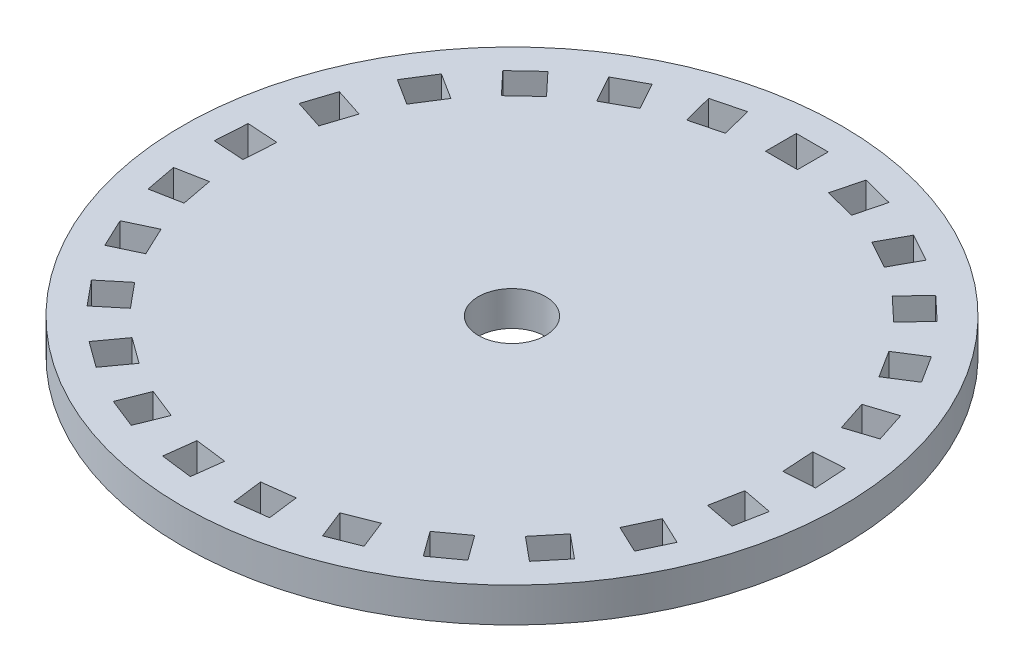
SolidWorks part; units mm, degrees
ref_plane "Front Plane" through (0, 0, 0) normal (0, 0, 1) x (1, 0, 0)
ref_plane "Top Plane" through (0, 0, 0) normal (0, 1, 0) x (1, 0, 0)
ref_plane "Right Plane" through (0, 0, 0) normal (1, 0, 0) x (0, 0, -1)
sketch "Sketch1" plane through (0, 0, 0) normal (0, 1, 0) x (1, 0, 0)
  line L0 (0, 0) -> (0, 28.575) construction
  line L1 (4.4706, 22.9781) -> (5.1338, 25.5613)
  line L2 (-1.3843, 23.368) -> (1.3843, 23.368)
  line L3 (-1.3843, 23.368) -> (-1.3843, 26.035)
  line L4 (-1.3843, 26.035) -> (1.3843, 26.035)
  line L5 (1.3843, 23.368) -> (1.3843, 26.035)
  line L6 (-1.3843, 23.368) -> (1.3843, 26.035) construction
  line L7 (-1.3843, 26.035) -> (1.3843, 23.368) construction
  line L8 (5.1338, 25.5613) -> (7.8155, 24.8728)
  line L9 (7.1522, 22.2896) -> (7.8155, 24.8728)
  line L10 (4.4706, 22.9781) -> (7.1522, 22.2896)
  line L11 (10.0445, 21.1444) -> (11.3294, 23.4815)
  line L12 (11.3294, 23.4815) -> (13.7555, 22.1478)
  line L13 (12.4707, 19.8106) -> (13.7555, 22.1478)
  line L14 (10.0445, 21.1444) -> (12.4707, 19.8106)
  line L15 (14.9874, 17.9822) -> (16.8131, 19.9263)
  line L16 (16.8131, 19.9263) -> (18.8313, 18.0311)
  line L17 (17.0056, 16.0869) -> (18.8313, 18.0311)
  line L18 (14.9874, 17.9822) -> (17.0056, 16.0869)
  line L19 (18.9885, 13.69) -> (21.2403, 15.1191)
  line L20 (21.2403, 15.1191) -> (22.7238, 12.7814)
  line L21 (20.472, 11.3524) -> (22.7238, 12.7814)
  line L22 (18.9885, 13.69) -> (20.472, 11.3524)
  line L23 (21.7965, 8.5377) -> (24.333, 9.3618)
  line L24 (24.333, 9.3618) -> (25.1885, 6.7287)
  line L25 (22.6521, 5.9046) -> (25.1885, 6.7287)
  line L26 (21.7965, 8.5377) -> (22.6521, 5.9046)
  line L27 (23.235, 2.8489) -> (25.8967, 3.0163)
  line L28 (25.8967, 3.0163) -> (26.0705, 0.2532)
  line L29 (23.4088, 0.0857) -> (26.0705, 0.2532)
  line L30 (23.235, 2.8489) -> (23.4088, 0.0857)
  line L31 (23.2135, -3.0189) -> (25.8332, -3.5187)
  line L32 (25.8332, -3.5187) -> (25.3145, -6.2383)
  line L33 (22.6947, -5.7385) -> (25.3145, -6.2383)
  line L34 (23.2135, -3.0189) -> (22.6947, -5.7385)
  line L35 (21.7334, -8.6971) -> (24.1466, -9.8326)
  line L36 (24.1466, -9.8326) -> (22.9678, -12.3377)
  line L37 (20.5546, -11.2022) -> (22.9678, -12.3377)
  line L38 (21.7334, -8.6971) -> (20.5546, -11.2022)
  line L39 (18.8877, -13.8287) -> (20.9427, -15.5287)
  line L40 (20.9427, -15.5287) -> (19.1779, -17.662)
  line L41 (17.123, -15.9619) -> (19.1779, -17.662)
  line L42 (18.8877, -13.8287) -> (17.123, -15.9619)
  line L43 (14.8553, -18.0914) -> (16.4229, -20.2491)
  line L44 (16.4229, -20.2491) -> (14.1831, -21.8764)
  line L45 (12.6154, -19.7188) -> (14.1831, -21.8764)
  line L46 (14.8553, -18.0914) -> (12.6154, -19.7188)
  line L47 (9.8894, -21.2174) -> (10.8712, -23.6971)
  line L48 (10.8712, -23.6971) -> (8.297, -24.7163)
  line L49 (7.3152, -22.2366) -> (8.297, -24.7163)
  line L50 (9.8894, -21.2174) -> (7.3152, -22.2366)
  line L51 (4.3022, -23.0102) -> (4.6364, -25.6562)
  line L52 (4.6364, -25.6562) -> (1.8897, -26.0032)
  line L53 (1.5554, -23.3572) -> (1.8897, -26.0032)
  line L54 (4.3022, -23.0102) -> (1.5554, -23.3572)
  line L55 (-1.5554, -23.3572) -> (-1.8897, -26.0032)
  line L56 (-1.8897, -26.0032) -> (-4.6364, -25.6562)
  line L57 (-4.3022, -23.0102) -> (-4.6364, -25.6562)
  line L58 (-1.5554, -23.3572) -> (-4.3022, -23.0102)
  line L59 (-7.3152, -22.2366) -> (-8.297, -24.7163)
  line L60 (-8.297, -24.7163) -> (-10.8712, -23.6971)
  line L61 (-9.8894, -21.2174) -> (-10.8712, -23.6971)
  line L62 (-7.3152, -22.2366) -> (-9.8894, -21.2174)
  line L63 (-12.6154, -19.7188) -> (-14.1831, -21.8764)
  line L64 (-14.1831, -21.8764) -> (-16.4229, -20.2491)
  line L65 (-14.8553, -18.0914) -> (-16.4229, -20.2491)
  line L66 (-12.6154, -19.7188) -> (-14.8553, -18.0914)
  line L67 (-17.123, -15.9619) -> (-19.1779, -17.662)
  line L68 (-19.1779, -17.662) -> (-20.9427, -15.5287)
  line L69 (-18.8877, -13.8287) -> (-20.9427, -15.5287)
  line L70 (-17.123, -15.9619) -> (-18.8877, -13.8287)
  line L71 (-20.5546, -11.2022) -> (-22.9678, -12.3377)
  line L72 (-22.9678, -12.3377) -> (-24.1466, -9.8326)
  line L73 (-21.7334, -8.6971) -> (-24.1466, -9.8326)
  line L74 (-20.5546, -11.2022) -> (-21.7334, -8.6971)
  line L75 (-22.6947, -5.7385) -> (-25.3145, -6.2383)
  line L76 (-25.3145, -6.2383) -> (-25.8332, -3.5187)
  line L77 (-23.2135, -3.0189) -> (-25.8332, -3.5187)
  line L78 (-22.6947, -5.7385) -> (-23.2135, -3.0189)
  line L79 (-23.4088, 0.0857) -> (-26.0705, 0.2532)
  line L80 (-26.0705, 0.2532) -> (-25.8967, 3.0163)
  line L81 (-23.235, 2.8489) -> (-25.8967, 3.0163)
  line L82 (-23.4088, 0.0857) -> (-23.235, 2.8489)
  line L83 (-22.6521, 5.9046) -> (-25.1885, 6.7287)
  line L84 (-25.1885, 6.7287) -> (-24.333, 9.3618)
  line L85 (-21.7965, 8.5377) -> (-24.333, 9.3618)
  line L86 (-22.6521, 5.9046) -> (-21.7965, 8.5377)
  line L87 (-20.472, 11.3524) -> (-22.7238, 12.7814)
  line L88 (-22.7238, 12.7814) -> (-21.2403, 15.1191)
  line L89 (-18.9885, 13.69) -> (-21.2403, 15.1191)
  line L90 (-20.472, 11.3524) -> (-18.9885, 13.69)
  line L91 (-17.0056, 16.0869) -> (-18.8313, 18.0311)
  line L92 (-18.8313, 18.0311) -> (-16.8131, 19.9263)
  line L93 (-14.9874, 17.9822) -> (-16.8131, 19.9263)
  line L94 (-17.0056, 16.0869) -> (-14.9874, 17.9822)
  line L95 (-12.4707, 19.8106) -> (-13.7555, 22.1478)
  line L96 (-13.7555, 22.1478) -> (-11.3294, 23.4815)
  line L97 (-10.0445, 21.1444) -> (-11.3294, 23.4815)
  line L98 (-12.4707, 19.8106) -> (-10.0445, 21.1444)
  line L99 (-7.1522, 22.2896) -> (-7.8155, 24.8728)
  line L100 (-7.8155, 24.8728) -> (-5.1338, 25.5613)
  line L101 (-4.4706, 22.9781) -> (-5.1338, 25.5613)
  line L102 (-7.1522, 22.2896) -> (-4.4706, 22.9781)
  circle A0 centre (0, 0) radius 28.575
  circle A1 centre (0, 0) radius 2.921
  point P4 (0, 24.7015)
  point P109 (0, 0)
  dimension "D1" = 57.15
  dimension "D6" = 5.842
  dimension "D2" = 2.54
  dimension "D3" = 2.667
  dimension "D4" = 2.7686
  dimension "D5" = 25
extrude "Boss-Extrude1" add sketch "Sketch1" along normal blind 2.9972
